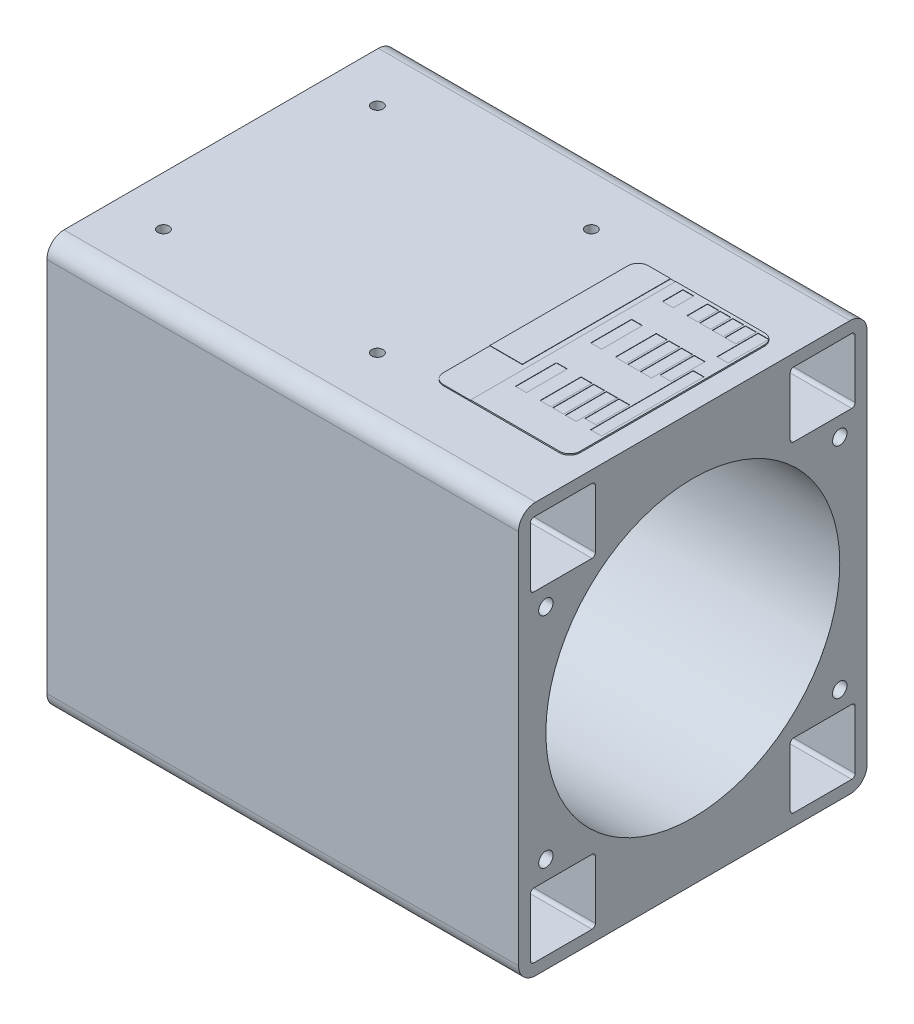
SolidWorks part; units mm, degrees
ref_plane "Front Plane" through (0, 0, 0) normal (0, 0, 1) x (1, 0, 0)
ref_plane "Top Plane" through (0, 0, 0) normal (0, 1, 0) x (1, 0, 0)
ref_plane "Right Plane" through (0, 0, 0) normal (1, 0, 0) x (0, 0, -1)
sketch "Sketch2" plane through (0, 0, 0) normal (1, 0, 0) x (0, 0, -1)
  line L0 (0, -2335.814) -> (0, 114454.8847) construction
  line L1 (-46, 60) -> (46, 60)
  line L2 (-51, 55) -> (-51, -55)
  line L3 (-46, -60) -> (46, -60)
  line L4 (51, 55) -> (51, -55)
  line L5 (-2335.814, 0) -> (114454.8847, 0) construction
  line L7 (-46.5, 56.5) -> (-29.5, 56.5)
  line L8 (-47.5, 55.5) -> (-47.5, 38.5)
  line L9 (-46.5, 37.5) -> (-29.5, 37.5)
  line L10 (-28.5, 55.5) -> (-28.5, 38.5)
  line L11 (46.5, 56.5) -> (29.5, 56.5)
  line L12 (47.5, 55.5) -> (47.5, 38.5)
  line L13 (46.5, 37.5) -> (29.5, 37.5)
  line L14 (28.5, 55.5) -> (28.5, 38.5)
  line L15 (-46.5, -56.5) -> (-29.5, -56.5)
  line L16 (-47.5, -55.5) -> (-47.5, -38.5)
  line L17 (-46.5, -37.5) -> (-29.5, -37.5)
  line L18 (-28.5, -55.5) -> (-28.5, -38.5)
  line L19 (46.5, -56.5) -> (29.5, -56.5)
  line L20 (47.5, -55.5) -> (47.5, -38.5)
  line L21 (46.5, -37.5) -> (29.5, -37.5)
  line L22 (28.5, -55.5) -> (28.5, -38.5)
  arc A0 (-51, -55) -> (-46, -60) centre (-46, -55) ccw
  arc A1 (46, -60) -> (51, -55) centre (46, -55) ccw
  arc A2 (46, 60) -> (51, 55) centre (46, 55) cw
  arc A3 (-46, 60) -> (-51, 55) centre (-46, 55) ccw
  arc A4 (46.5, -56.5) -> (47.5, -55.5) centre (46.5, -55.5) ccw
  arc A5 (29.5, -56.5) -> (28.5, -55.5) centre (29.5, -55.5) cw
  arc A6 (47.5, -38.5) -> (46.5, -37.5) centre (46.5, -38.5) ccw
  arc A7 (29.5, -37.5) -> (28.5, -38.5) centre (29.5, -38.5) ccw
  arc A8 (-47.5, -38.5) -> (-46.5, -37.5) centre (-46.5, -38.5) cw
  arc A9 (-46.5, -56.5) -> (-47.5, -55.5) centre (-46.5, -55.5) cw
  arc A10 (-29.5, -56.5) -> (-28.5, -55.5) centre (-29.5, -55.5) ccw
  arc A11 (-29.5, -37.5) -> (-28.5, -38.5) centre (-29.5, -38.5) cw
  arc A12 (29.5, 37.5) -> (28.5, 38.5) centre (29.5, 38.5) cw
  arc A13 (47.5, 38.5) -> (46.5, 37.5) centre (46.5, 38.5) cw
  arc A14 (46.5, 56.5) -> (47.5, 55.5) centre (46.5, 55.5) cw
  arc A15 (29.5, 56.5) -> (28.5, 55.5) centre (29.5, 55.5) ccw
  arc A16 (-47.5, 38.5) -> (-46.5, 37.5) centre (-46.5, 38.5) ccw
  arc A17 (-29.5, 37.5) -> (-28.5, 38.5) centre (-29.5, 38.5) ccw
  arc A18 (-29.5, 56.5) -> (-28.5, 55.5) centre (-29.5, 55.5) cw
  arc A19 (-46.5, 56.5) -> (-47.5, 55.5) centre (-46.5, 55.5) ccw
  circle A20 centre (0, 0) radius 43
  point P59 (-47.5, 37.5)
  point P66 (-47.5, 56.5)
extrude "Boss-Extrude1" add sketch "Sketch2" along normal mid plane 138
hole_wizard "Tap Drill for M5x0.8 Tap1" positions "Sketch4" profile "Sketch3" hole size "M5x0.8" standard "ANSI Metric"
sketch "Sketch4" plane through (69, 0, 0) normal (1, 0, 0) x (0, 0, -1)
  line L0 (-1000, 0) -> (49000, 0) construction
  line L1 (0, -1000) -> (0, 49000) construction
  point P0 (-43, 32)
  point P4 (43, 32)
  point P8 (43, -32)
  point P12 (-43, -32)
  dimension "D1" = 86
  dimension "D2" = 64
sketch "Sketch3" plane through (69, 32, 43) normal (0, 1, 0) x (0, 0, -1)
  line L0 (0, 0) -> (0, 16.2618)
  line L1 (0, 16.2618) -> (2.1, 15)
  line L2 (2.1, 15) -> (2.1, 0)
  line L5 (2.1, 0) -> (0, 0)
  line L10 (0, 16.2618) -> (-2.1, 15) construction
  line L11 (0, -6.35) -> (0, 107.95) construction
  dimension "Hole Dia." = 4.2
  dimension "Hole Depth" = 15
  dimension "Drill Angle" = 118
mirror "Mirror1" about plane through (0, 0, 0) normal (1, 0, 0) of "Tap Drill for M5x0.8 Tap1"
hole_wizard "Tap Drill for M8x1.0 Tap1" positions "Sketch6" profile "Sketch5" hole size "M8x1.0" standard "ANSI Metric"
sketch "Sketch6" plane through (0, 0, -51) normal (0, 0, -1) x (-1, 0, 0)
  line L0 (0, -1000) -> (0, 49000) construction
  line L1 (-1000, 0) -> (49000, 0) construction
  point P0 (-44, 27.5)
  point P2 (44, 27.5)
  point P4 (-44, -27.5)
  point P6 (44, -27.5)
sketch "Sketch5" plane through (44, 27.5, -51) normal (1, 0, 0) x (0, 1, 0)
  line L0 (0, 0) -> (0, 14.103)
  line L1 (0, 14.103) -> (3.5, 12)
  line L2 (3.5, 12) -> (3.5, 0)
  line L5 (3.5, 0) -> (0, 0)
  line L10 (0, 14.103) -> (-3.5, 12) construction
  line L11 (0, -6.35) -> (0, 107.95) construction
  dimension "Hole Dia." = 7
  dimension "Hole Depth" = 12
  dimension "Drill Angle" = 118
hole_wizard "Tap Drill for M4x0.7 Tap2" positions "Sketch8" profile "Sketch7" hole size "M4x0.7" standard "ANSI Metric"
sketch "Sketch8" plane through (0, 60, 0) normal (0, 1, 0) x (1, 0, 0)
  line L2 (-1069, 0) -> (48931, 0) construction
  line L3 (-69, 46) -> (-69, -46) construction
  line L4 (69, 46) -> (69, -46) construction
  point P0 (-54.6, 31.3)
  point P4 (8, 31.3)
  point P8 (8, -31.3)
  point P12 (-54.6, -31.3)
  point P29 (-69, 0)
  dimension "D1" = 62.6
  dimension "D2" = 62.6
  dimension "D3" = 61
sketch "Sketch7" plane through (-54.6, 60, -31.3) normal (1, 0, 0) x (0, 0, 1)
  line L0 (0, 0) -> (0, 3.5)
  line L1 (0, 3.5) -> (1.65, 3.5)
  line L2 (1.65, 3.5) -> (1.65, 0)
  line L5 (1.65, 0) -> (0, 0)
  line L11 (0, -6.35) -> (0, 107.95) construction
  dimension "Thru Hole Dia." = 3.3
  dimension "Thru Hole Depth" = 3.5
sketch "Sketch9" plane through (0, 60, 0) normal (0, 1, 0) x (1, 0, 0)
  line L0 (-1069, 0) -> (48931, 0) construction
  line L1 (26, -30) -> (60, -30)
  line L2 (23, -27) -> (23, 27)
  line L3 (26, 30) -> (60, 30)
  line L4 (63, -27) -> (63, 27)
  line L5 (-69, 46) -> (-69, -46) construction
  line L6 (69, 46) -> (69, -46) construction
  arc A0 (26, -30) -> (23, -27) centre (26, -27) cw
  arc A1 (60, -30) -> (63, -27) centre (60, -27) ccw
  arc A2 (60, 30) -> (63, 27) centre (60, 27) cw
  arc A3 (23, 27) -> (26, 30) centre (26, 27) cw
  point P9 (-69, 0)
  point P17 (63, 30)
  point P20 (23, 30)
  dimension "D4" = 3
  dimension "D1" = 60
  dimension "D2" = 40
  dimension "D3" = 6
extrude "Boss-Extrude2" add sketch "Sketch9" along normal blind 0.4 separate body
sketch "Sketch10" plane through (0, 60.4, 0) normal (0, 1, 0) x (1, 0, 0)
  line L1 (23, -30) -> (34, -30)
  line L2 (23, -30) -> (23, -13.3875)
  line L3 (23, -13.3875) -> (32.5, -13.3875)
  line L4 (34, -30) -> (34, -13.3875)
  line L6 (34, -13.3875) -> (34, 30)
  line L7 (34, 30) -> (32.5, 30)
  line L8 (60, 30) -> (26, 30) construction
  line L9 (37.1, -20) -> (40.3, -20)
  line L10 (37.1, -20) -> (37.1, -8)
  line L11 (37.1, -8) -> (40.3, -8)
  line L12 (40.3, -20) -> (40.3, -8)
  line L13 (37.1, 2) -> (40.3, 2)
  line L14 (37.1, 2) -> (37.1, 14)
  line L15 (37.1, 14) -> (40.3, 14)
  line L16 (40.3, 2) -> (40.3, 14)
  line L17 (37.1, 23) -> (40.3, 23)
  line L18 (37.1, 23) -> (37.1, 29)
  line L19 (37.1, 29) -> (40.3, 29)
  line L20 (40.3, 23) -> (40.3, 29)
  line L21 (44.3, -20) -> (47.5, -20)
  line L22 (44.3, -20) -> (44.3, -8)
  line L23 (44.3, -8) -> (47.5, -8)
  line L24 (47.5, -20) -> (47.5, -8)
  line L25 (44.3, 2) -> (47.5, 2)
  line L26 (44.3, 2) -> (44.3, 14)
  line L27 (44.3, 14) -> (47.5, 14)
  line L28 (47.5, 2) -> (47.5, 14)
  line L29 (44.3, 23) -> (47.5, 23)
  line L30 (44.3, 23) -> (44.3, 29)
  line L31 (44.3, 29) -> (47.5, 29)
  line L32 (47.5, 23) -> (47.5, 29)
  line L33 (48, -20) -> (51.2, -20)
  line L34 (48, -20) -> (48, -8)
  line L35 (48, -8) -> (51.2, -8)
  line L36 (51.2, -20) -> (51.2, -8)
  line L37 (48, 2) -> (51.2, 2)
  line L38 (48, 2) -> (48, 14)
  line L39 (48, 14) -> (51.2, 14)
  line L40 (51.2, 2) -> (51.2, 14)
  line L41 (48, 23) -> (51.2, 23)
  line L42 (48, 23) -> (48, 29)
  line L43 (48, 29) -> (51.2, 29)
  line L44 (51.2, 23) -> (51.2, 29)
  line L45 (51.7, -20) -> (54.9, -20)
  line L46 (51.7, -20) -> (51.7, -8)
  line L47 (51.7, -8) -> (54.9, -8)
  line L48 (54.9, -20) -> (54.9, -8)
  line L49 (51.7, 2) -> (54.9, 2)
  line L50 (51.7, 2) -> (51.7, 14)
  line L51 (51.7, 14) -> (54.9, 14)
  line L52 (54.9, 2) -> (54.9, 14)
  line L53 (51.7, 23) -> (54.9, 23)
  line L54 (51.7, 23) -> (51.7, 29)
  line L55 (51.7, 29) -> (54.9, 29)
  line L56 (54.9, 23) -> (54.9, 29)
  line L57 (55.4, -18) -> (58.6, -18)
  line L58 (55.4, -18) -> (55.4, -8)
  line L59 (55.4, -8) -> (58.6, -8)
  line L60 (58.6, -18) -> (58.6, -8)
  line L61 (55.4, 4) -> (58.6, 4)
  line L62 (55.4, 4) -> (55.4, 14)
  line L63 (55.4, 14) -> (58.6, 14)
  line L64 (58.6, 4) -> (58.6, 14)
  line L65 (55.4, 23) -> (58.6, 23)
  line L66 (55.4, 23) -> (55.4, 29)
  line L67 (55.4, 29) -> (58.6, 29)
  line L68 (58.6, 23) -> (58.6, 29)
  line L69 (59.1, -20) -> (62.3, -20)
  line L70 (59.1, -20) -> (59.1, 10)
  line L71 (59.1, 10) -> (62.3, 10)
  line L72 (62.3, -20) -> (62.3, 10)
  line L73 (59.1, 29) -> (62.3, 29)
  line L74 (59.1, 29) -> (59.1, 17)
  line L75 (59.1, 17) -> (62.3, 17)
  line L76 (62.3, 29) -> (62.3, 17)
  line L77 (26, -30) -> (60, -30) construction
  line L78 (23, 27) -> (23, -27) construction
  line L79 (32.5, 30) -> (32.5, -13.3875)
  dimension "D1" = 3.2
  dimension "D2" = 0.5
  dimension "D3" = 0.5
  dimension "D4" = 0.5
  dimension "D5" = 0.5
  dimension "D6" = 4
  dimension "D7" = 3.1
  dimension "D8" = 1.5
  dimension "D9" = 10
  dimension "D10" = 12
  dimension "D11" = 10
  dimension "D12" = 6
  dimension "D13" = 9
  dimension "D14" = 12
  dimension "D15" = 11
  dimension "D16" = 12
  dimension "D17" = 30
extrude "Cut-Extrude1" cut sketch "Sketch10" against normal blind 0.1
equation "\"L1\"= 251mm"
equation "\"P\"= 57mm"
equation "\"K\"= 88mm"
equation "\"M\"= 138mm"
equation "\"D1@Boss-Extrude1\"=\"M\""
equation "\"X\"= 102mm"
equation "\"Y\"= 120mm"
equation "\"D2@Sketch2\"=\"Y\""
equation "\"D1@Sketch2\"=\"X\""
equation "\"D2@Sketch6\"=\"K\""
